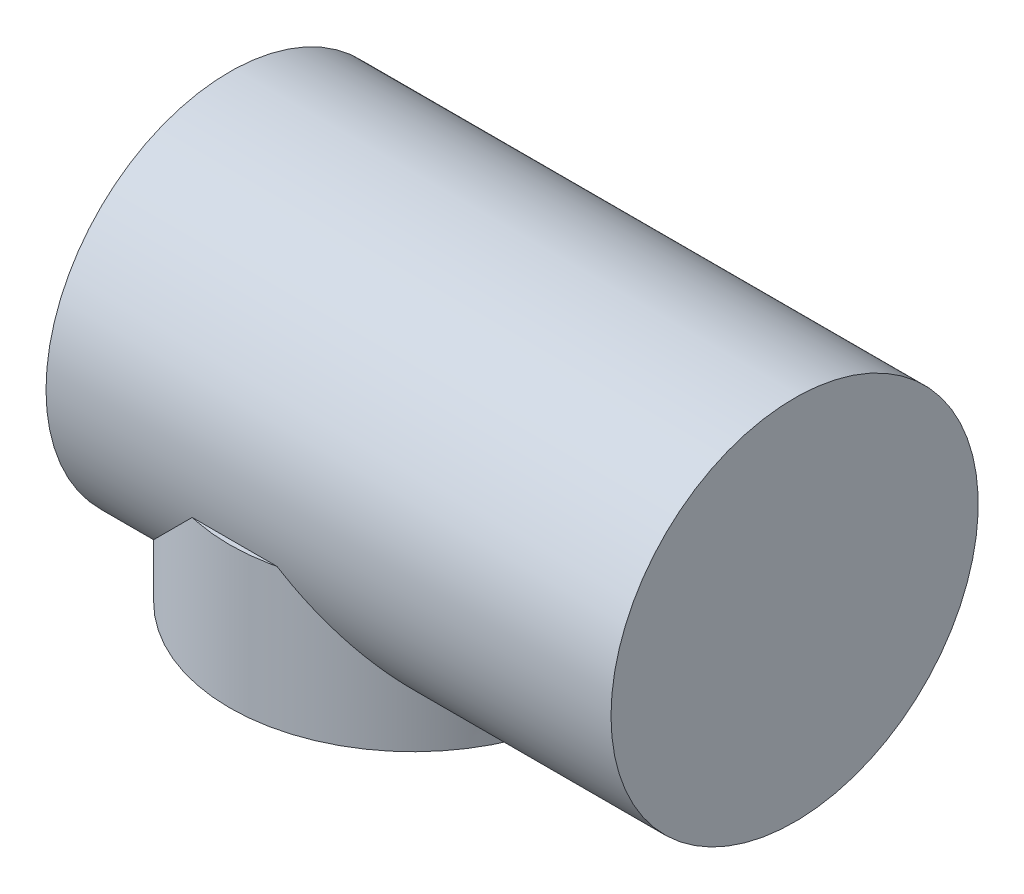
SolidWorks part; units mm, degrees
ref_plane "Alzado" through (0, 0, 0) normal (0, 0, 1) x (1, 0, 0)
ref_plane "Planta" through (0, 0, 0) normal (0, 1, 0) x (1, 0, 0)
ref_plane "Vista lateral" through (0, 0, 0) normal (1, 0, 0) x (0, 0, -1)
sketch "Croquis2" plane through (0, 0, 0) normal (0, 1, 0) x (1, 0, 0)
  circle A0 centre (0, 0) radius 26
  dimension "D1" = 52
extrude "Saliente-Extruir1" add sketch "Croquis2" along normal blind 20
ref_plane "Plano2" through (-26, 0, 0) normal (-1, 0, 0) x (0, 0, 1)
sketch "Croquis4" plane through (-26, 0, 0) normal (-1, 0, 0) x (0, 0, 1)
  line L1 (-26, 0) -> (26, 0) construction
  circle A0 centre (0, 26) radius 26
  dimension "D2" = 52
  dimension "D1" = 26
extrude "Saliente-Extruir2" add sketch "Croquis4" against normal blind 80
sketch "Croquis6" plane through (0, 0, 0) normal (0, -1, 0) x (1, 0, 0)
  circle A0 centre (0, 0) radius 25
  dimension "D1" = 50
extrude "Cortar-Extruir1" cut sketch "Croquis6" against normal blind 10
